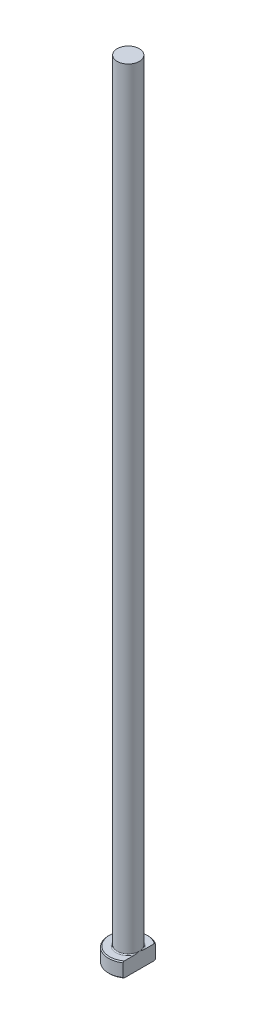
SolidWorks part; units mm, degrees
ref_plane "Front Plane" through (0, 0, 0) normal (0, 0, 1) x (1, 0, 0)
ref_plane "Top Plane" through (0, 0, 0) normal (0, 1, 0) x (1, 0, 0)
ref_plane "Right Plane" through (0, 0, 0) normal (1, 0, 0) x (0, 0, -1)
sketch "Sketch1" plane through (0, 0, 0) normal (0, 0, 1) x (1, 0, 0)
  line L0 (0, 259.9588) -> (0, -15.1925) construction
  line L1 (0, 0) -> (-4, 0)
  line L2 (-4, 0) -> (-4, 3)
  line L3 (-4, 3) -> (-2.25, 3)
  line L4 (-2.25, 3) -> (-2.25, 160)
  line L5 (-2.25, 160) -> (0, 160)
  line L6 (0, 160) -> (0, 0)
  dimension "L" = 160
  dimension "H" = 8
  dimension "T" = 3
  dimension "D" = 4.5
revolve "Revolve1" add sketch "Sketch1" angle 360 about L0
chamfer "Chamfer1" distance 0.2 angle 45 2 edges at (0, 3, 4) (0, 0, 4)
fillet "Fillet1" radius 0.2 1 edges at (0, 3, 2.25)
sketch "Sketch2" plane through (0, 0, 0) normal (0, 1, 0) x (1, 0, 0)
  line L0 (2.25, 3.3072) -> (2.25, -3.3072)
  circle A0 centre (0, 0) radius 4 construction
  arc A1 (2.25, -3.3072) -> (2.25, 3.3072) centre (0, 0) ccw
  circle A2 centre (0, 0) radius 2.25 construction
extrude "KEY" cut sketch "Sketch2" along normal through all
